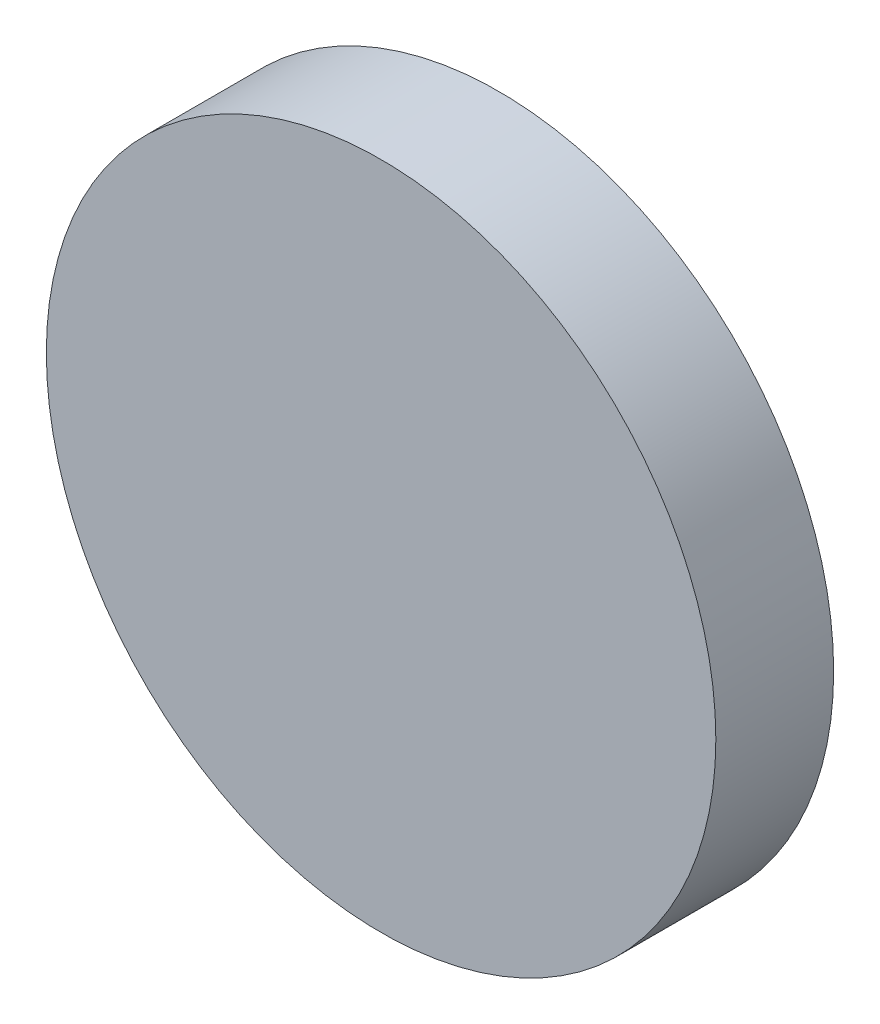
SolidWorks part; units mm, degrees
ref_plane "Front Plane" through (0, 0, 0) normal (0, 0, 1) x (1, 0, 0)
ref_plane "Top Plane" through (0, 0, 0) normal (0, 1, 0) x (1, 0, 0)
ref_plane "Right Plane" through (0, 0, 0) normal (1, 0, 0) x (0, 0, -1)
sketch "Sketch1" plane through (0, 0, 0) normal (0, 0, 1) x (1, 0, 0)
  circle A0 centre (0, 0) radius 63.5
extrude "Boss-Extrude1" add sketch "Sketch1" along normal blind 22.352
sketch "Sketch2" plane through (0, 0, 0) normal (0, 0, 1) x (1, 0, 0)
  circle A0 centre (0, 0) radius 19.05
extrude "Boss-Extrude2" add sketch "Sketch2" along normal blind 12.7
